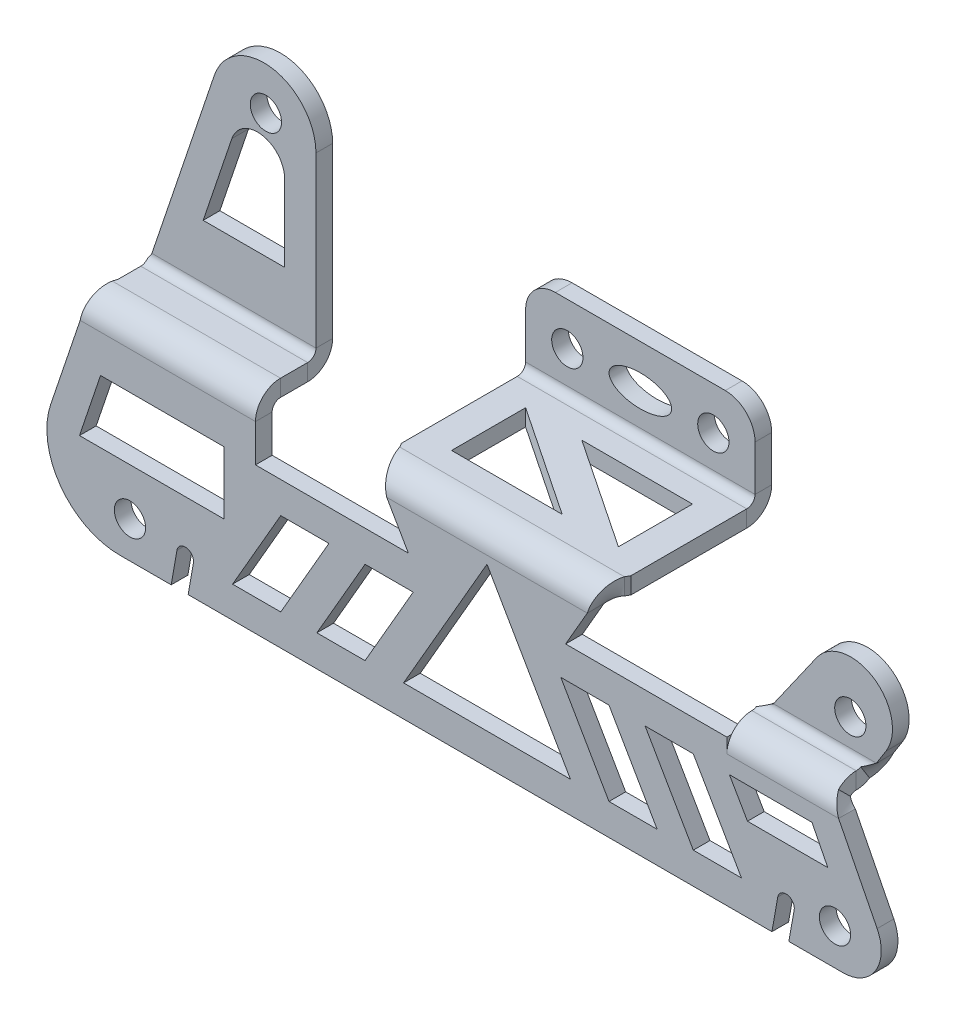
SolidWorks part; units mm, degrees
ref_plane "Face" through (0, 0, 0) normal (0, 0, 1) x (1, 0, 0)
ref_plane "Dessus" through (0, 0, 0) normal (0, 1, 0) x (1, 0, 0)
ref_plane "Droite" through (0, 0, 0) normal (1, 0, 0) x (0, 0, -1)
sketch "Esquisse1" plane through (0, 0, 0) normal (0, 0, 1) x (1, 0, 0)
  line L0 (33.8, 0) -> (0, 0) construction
  line L1 (1.1482, 17.5478) -> (-3.8001, 2.852)
  line L2 (-0.4938, -1.75) -> (34.1915, -1.75)
  line L3 (35.8204, 0.9012) -> (33.6175, 5.25)
  line L4 (22.6175, 8.25) -> (22.6175, 5.25)
  line L5 (33.6175, 5.25) -> (34.6471, 6.8837)
  line L6 (31.3178, 9.0987) -> (28.6175, 5.25)
  line L7 (36.0175, 0.076) -> (36.0175, -6.5966) construction
  line L8 (28.6175, 5.25) -> (22.6175, 5.25) construction
  line L9 (-3.9825, 1.7387) -> (-3.9825, -1.75) construction
  line L10 (31.1175, 5.25) -> (32.955, 7.95) construction
  line L11 (22.6175, 8.25) -> (22.6175, 10.8229)
  line L12 (21.1904, 12.25) -> (13.0446, 12.25)
  line L13 (11.6175, 10.8229) -> (11.6175, 8.25)
  line L14 (6.0175, 16.75) -> (6.0175, 5.25)
  line L15 (6.0175, 5.25) -> (11.6175, 5.25)
  line L16 (28.6175, 5.25) -> (33.6175, 5.25) construction
  line L17 (31.3919, 5.25) -> (32.9354, 7.45) construction
  line L18 (11.6175, 5.25) -> (11.6175, 8.25)
  line L19 (22.6175, 5.25) -> (22.6175, 3.25)
  line L20 (34.955, 7.95) -> (34.955, 21.0612) construction
  line L21 (22.6175, 8.25) -> (11.6175, 8.25) construction
  line L22 (17.1175, 12.25) -> (17.1175, 8.25) construction
  line L24 (17.1175, 10.95) -> (13.6175, 10.95) construction
  line L25 (17.1175, 9.45) -> (13.6175, 9.45) construction
  line L26 (22.6175, 3.25) -> (28.6175, 3.25)
  line L27 (28.6175, 3.25) -> (28.6175, 5.25)
  line L28 (6.0175, 8.25) -> (-1.9825, 8.25) construction
  line L29 (-0.4938, -1.75) -> (-3.9825, -1.75) construction
  line L30 (11.8766, 19.25) -> (-0.1493, 19.25) construction
  line L31 (32.955, 9.95) -> (51.4302, 9.95) construction
  circle A0 centre (0, 0) radius 0.75
  circle A1 centre (33.8, 0) radius 0.75
  arc A2 (34.6471, 6.8837) -> (31.3178, 9.0987) centre (32.955, 7.95) ccw
  arc A3 (22.6175, 10.8229) -> (21.1904, 12.25) centre (21.1904, 10.8229) ccw
  arc A4 (13.0446, 12.25) -> (11.6175, 10.8229) centre (13.0446, 10.8229) ccw
  arc A5 (6.0175, 16.75) -> (1.1482, 17.5478) centre (3.5175, 16.75) ccw
  circle A6 centre (13.6175, 10.2) radius 0.75
  circle A7 centre (20.6175, 10.2) radius 0.75
  arc A8 (35.8204, 0.9012) -> (34.1915, -1.75) centre (34.1915, 0.076) cw
  arc A9 (-3.8001, 2.852) -> (-0.4938, -1.75) centre (-0.4938, 1.7387) ccw
  circle A10 centre (3.6175, 17.2) radius 0.75
  circle A11 centre (32.9354, 7.45) radius 0.75
  ellipse E0 centre (17.1175, 10.2) end of major axis (15.6175, 10.2) minor radius 0.75
  dimension "D1" = 1.5
  dimension "D4" = 7.5
  dimension "D5" = 2
  dimension "D6" = 8
  dimension "D7" = 10
  dimension "D25" = 11.7
  dimension "D9" = 0.8
  dimension "D26" = 1.826
  dimension "D29" = 3.4887
  dimension "D30" = 2.5
  dimension "D16" = 2
  dimension "D31" = 2.05
  dimension "D2" = 33.8
  dimension "D3" = 1.75
  dimension "D8" = 7
  dimension "D10" = 3.5
  dimension "D11" = 40
  dimension "D12" = 21
  dimension "D13" = 54.946
  dimension "D14" = 5
  dimension "D15" = 1.75
  dimension "D17" = 7
  dimension "D18" = 10
  dimension "D19" = 4
  dimension "D20" = 11
  dimension "D21" = 10
  dimension "D22" = 13.6175
  dimension "D23" = 24.4
  dimension "D24" = 5.6
  dimension "D27" = 2.2175
  dimension "D28" = 6
  dimension "D32" = 71.391
sheet metal parameters "Tôlerie 2" thickness 0.8 parameters "D1"=0.7366, "Epaisseur"=0.8
base flange "Tôle de base pliée2" sketch "Esquisse1" thickness 0.8 reverse thickness direction yes parameters "D1"=0.7366
sketch "Esquisse6" plane through (0, 0, 0.8) normal (0, 0, 1) x (1, 0, 0)
  line L0 (22.6175, 5.25) -> (20.8855, 5.25)
  line L1 (20.8855, 5.25) -> (22.6175, 8.25)
  line L2 (22.6175, 8.25) -> (22.6175, 5.25)
  line L3 (11.6175, 8.25) -> (13.3496, 5.25)
  line L4 (13.3496, 5.25) -> (6.0175, 5.25)
  line L5 (6.0175, 5.25) -> (6.0175, 8.25)
  line L6 (6.0175, 8.25) -> (11.6175, 8.25)
  dimension "D1" = 60
  dimension "D2" = 60
extrude "Extrusion1" cut sketch "Esquisse6" against normal blind 10
sketch "Esquisse8" plane through (0, 0, 0) normal (0, 0, -1) x (-1, 0, 0)
  line L0 (-28.6175, 5.25) -> (-33.6175, 5.25)
jog "Décalage15" parameters "D1"=0.4
bend "DécalagePli17" bend radius 0.4 bend angle 90 parameters "D5"=1
bend "DécalagePli18" bend radius 0.4 bend angle 90 parameters "D5"=2
sketch "Esquisse12" plane through (0, 0, 0.8) normal (0, 0, 1) x (1, 0, 0)
  line L1 (22.6175, 3.25) -> (28.6175, 3.25)
  line L2 (22.6175, 3.25) -> (22.6175, 5.25)
  line L3 (22.6175, 5.25) -> (28.6175, 5.25)
  line L4 (28.6175, 3.25) -> (28.6175, 5.25)
extrude "Extrusion3" add sketch "Esquisse12" against normal up to surface (0.8 mm away)
sketch "Esquisse9" plane through (0, 0, 0.8) normal (0, 0, 1) x (1, 0, 0)
  line L0 (-1.9825, 8.25) -> (6.0175, 8.25)
  line L3 (1.1482, 17.5478) -> (-3.8001, 2.852) construction
  line L5 (6.0175, 16.75) -> (6.0175, 5.25) construction
  line L6 (22.6175, 8.25) -> (11.6175, 8.25) construction
jog "Décalage16" parameters "D1"=0.4
bend "DécalagePli19" bend radius 0.4 bend angle 90 parameters "D5"=3
bend "DécalagePli20" bend radius 0.4 bend angle 90 parameters "D5"=4
sketch "Esquisse10" plane through (0, 0, 0.8) normal (0, 0, 1) x (1, 0, 0)
  line L0 (11.6175, 8.25) -> (22.6175, 8.25)
  line L1 (11.6175, 8.25) -> (13.3496, 5.25) construction
  line L2 (22.6175, 8.25) -> (20.8855, 5.25) construction
  line L3 (-1.9825, 8.25) -> (6.0175, 8.25) construction
jog "Décalage17" parameters "D1"=0.4
bend "DécalagePli21" bend radius 0.4 bend angle 90 parameters "D5"=5
bend "DécalagePli22" bend radius 0.4 bend angle 90 parameters "D5"=6
sketch "Esquisse11" plane through (0, 0, 0.8) normal (0, 0, 1) x (-1, 0, 0)
  line L0 (-1.9761, 1.75) -> (-2.3234, -0.2196)
  line L1 (0.4938, 1.75) -> (-34.1915, 1.75) construction
  line L2 (-2.3234, -0.2196) -> (-3.1113, -0.0807)
  line L3 (-3.1113, -0.0807) -> (-2.764, 1.8889)
  line L4 (-2.764, 1.8889) -> (-1.9761, 1.75)
  dimension "D1" = 2
  dimension "D2" = 80
  dimension "D3" = 0.8
  dimension "D4" = 2.25
extrude "Extrusion2" cut sketch "Esquisse11" against normal through all
fillet "Congé1" radius 0.4 2 edges at (3.1113, 0.0807, 0.4) (2.3234, 0.2196, 0.4)
pattern_linear "Répétition linéaire1" count 2 spacing 28.8 along (1, 0, 0) of "Extrusion2", "Congé1"
sketch "Esquisse13" plane through (0, 0, 0.8) normal (0, 0, 1) x (1, 0, 0)
  line L0 (13.1175, -0.25) -> (21.1175, -0.25)
  line L1 (21.1175, -0.25) -> (17.1175, 6.6782)
  line L2 (17.1175, 6.6782) -> (13.1175, -0.25)
  line L3 (2.7885, -1.75) -> (30.7761, -1.75) construction
  line L4 (11.6175, 8.25) -> (22.6175, 8.25) construction
  line L5 (17.1175, 8.25) -> (17.1175, 6.6782) construction
  line L6 (20.6556, 3.75) -> (22.965, -0.25)
  line L7 (20.6556, 3.75) -> (22.965, 3.75)
  line L8 (22.965, -0.25) -> (25.2744, -0.25)
  line L9 (22.965, 3.75) -> (25.2744, -0.25)
  line L10 (28.6175, 5.25) -> (20.8855, 5.25) construction
  line L11 (24.6971, 3.75) -> (27.0065, -0.25)
  line L12 (24.6971, 3.75) -> (27.0065, 3.75)
  line L13 (27.0065, -0.25) -> (29.3159, -0.25)
  line L14 (27.0065, 3.75) -> (29.3159, -0.25)
  line L15 (7.2285, 3.75) -> (4.9191, -0.25)
  line L16 (7.2285, -0.25) -> (4.9191, -0.25)
  line L17 (9.5379, 3.75) -> (7.2285, 3.75)
  line L18 (9.5379, 3.75) -> (7.2285, -0.25)
  line L19 (11.27, 3.75) -> (8.9606, -0.25)
  line L20 (11.27, -0.25) -> (8.9606, -0.25)
  line L21 (13.5794, 3.75) -> (11.27, 3.75)
  line L22 (13.5794, 3.75) -> (11.27, -0.25)
  line L23 (32.6959, 3.75) -> (33.4557, 2.25)
  line L25 (33.4557, 2.25) -> (29.6046, 2.25)
  line L26 (29.6046, 2.25) -> (28.7385, 3.75)
  line L27 (28.7385, 3.75) -> (32.6959, 3.75)
  line L28 (35.8204, 0.9012) -> (33.9721, 4.55) construction
  line L29 (33.8, 0.75) -> (39.3474, 0.75) construction
  line L30 (4.5175, 5.25) -> (4.5175, 2.25)
  line L31 (4.5175, 2.25) -> (-2.42, 2.25)
  line L32 (-2.42, 2.25) -> (-1.4099, 5.25)
  line L33 (-1.4099, 5.25) -> (4.5175, 5.25)
  line L34 (6.0175, 5.25) -> (6.0175, 7.05) construction
  line L35 (-2.3865, 7.05) -> (-3.8001, 2.852) construction
  line L36 (-1.9825, 8.25) -> (6.0175, 8.25) construction
  line L37 (4.5175, 14.9189) -> (4.5175, 11.25)
  line L38 (4.5175, 11.25) -> (0.6104, 11.25)
  line L39 (0.6104, 11.25) -> (1.9855, 15.3338)
  line L42 (6.0175, 16.75) -> (6.0175, 5.25) construction
  line L43 (1.1482, 17.5478) -> (-3.8001, 2.852) construction
  line L44 (6.0175, 8.25) -> (-1.9825, 8.25) construction
  circle A0 centre (33.8, 0) radius 0.75 construction
  arc A1 (1.9855, 15.3338) -> (4.5175, 14.9189) centre (3.2175, 14.9189) cw
  point P48 (17.1175, -0.25)
  dimension "D18" = 1.3
  dimension "D1" = 1.5
  dimension "D2" = 8
  dimension "D3" = 8
  dimension "D4" = 1.5
  dimension "D5" = 1.6
  dimension "D6" = 1.5
  dimension "D7" = 2
  dimension "D8" = 4.1569
  dimension "D9" = 1.5
  dimension "D10" = 1.5
  dimension "D11" = 1.5
  dimension "D12" = 1.5
  dimension "D13" = 1.5
  dimension "D14" = 2.25
  dimension "D15" = 1.5
  dimension "D16" = 3
  dimension "D17" = 3
extrude "Extrusion4" cut sketch "Esquisse13" against normal through all
sketch "Esquisse14" plane through (0, 8.25, 0) normal (0, 1, 0) x (1, 0, 0)
  line L0 (21.1175, 1.5) -> (15.8141, 5.05)
  line L1 (15.8141, 5.05) -> (21.1175, 5.05)
  line L2 (21.1175, 5.05) -> (21.1175, 1.5)
  line L3 (13.1175, 5.05) -> (13.1175, 1.5)
  line L4 (13.1175, 1.5) -> (18.4209, 1.5)
  line L5 (18.4209, 1.5) -> (13.1175, 5.05)
  line L6 (22.6175, 6.15) -> (22.6175, 0.6) construction
  line L7 (21.1904, 6.55) -> (13.0446, 6.55) construction
  line L8 (13.3496, 0) -> (6.0175, 0) construction
  line L9 (11.6175, 6.15) -> (11.6175, 0.6) construction
  point P12 (11.6175, 3.375)
  dimension "D1" = 1.5
  dimension "D2" = 1.5
  dimension "D3" = 1.5
  dimension "D4" = 1.5
  dimension "D5" = 1.5
extrude "Extrusion5" cut sketch "Esquisse14" against normal through all
flat pattern "Etat déplié2"
sketch "Lignes de pliage2" plane through (0, 0, 0) normal (0, 1, 0) x (-1, 0, 0)
bend of the flat pattern "Dépliage-<DécalagePli17>1"
bend of the flat pattern "Dépliage-<DécalagePli18>1"
bend of the flat pattern "Dépliage-<DécalagePli19>1"
bend of the flat pattern "Dépliage-<DécalagePli20>1"
bend of the flat pattern "Dépliage-<DécalagePli21>1"
bend of the flat pattern "Dépliage-<DécalagePli22>1"
